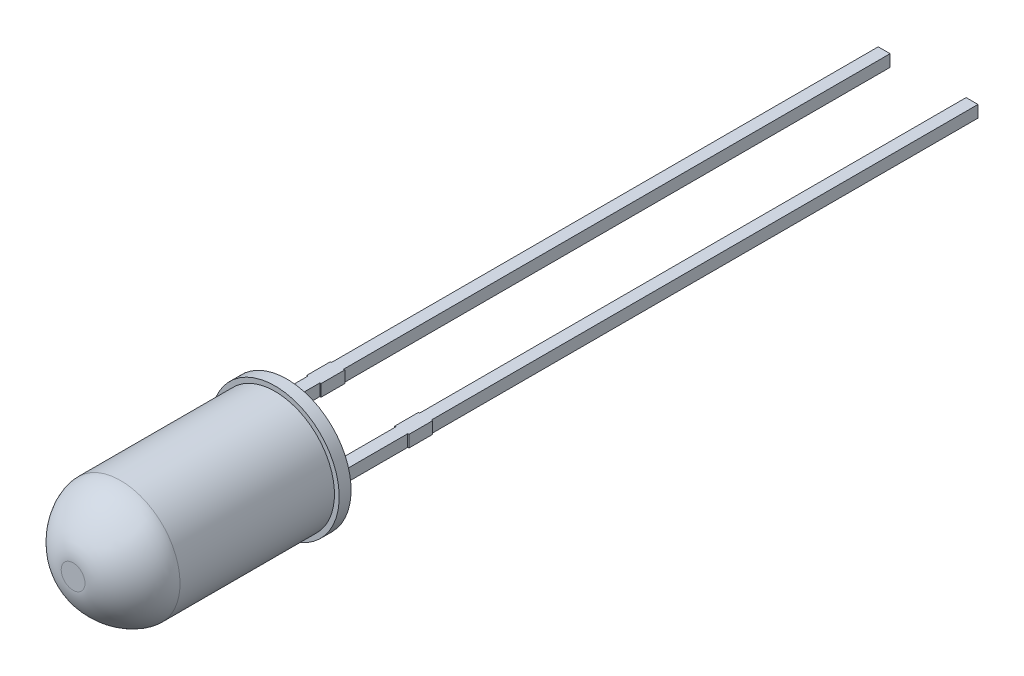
SolidWorks part; units mm, degrees
ref_plane "Plan de face" through (0, 0, 0) normal (0, 0, 1) x (1, 0, 0)
ref_plane "Plan de dessus" through (0, 0, 0) normal (0, 1, 0) x (1, 0, 0)
ref_plane "Plan de droite" through (0, 0, 0) normal (1, 0, 0) x (0, 0, -1)
sketch "Esquisse1" plane through (0, 0, 0) normal (0, 0, 1) x (1, 0, 0)
  circle A0 centre (0, 0) radius 2.5
extrude "Boss.-Extru.1" add sketch "Esquisse1" along normal blind 9
fillet "Congé1" radius 2 1 edges at (2.5, 0, 9)
sketch "Esquisse3" plane through (0, 0, 0) normal (0, 0, -1) x (-1, 0, 0)
  circle A0 centre (0, 0) radius 2.7
extrude "Boss.-Extru.3" add sketch "Esquisse3" against normal blind 0.5
sketch "Esquisse4" plane through (0, 0, 0) normal (0, 0, -1) x (-1, 0, 0)
  line L0 (0, 0) -> (-2.7, 0)
  line L1 (0, 0) -> (2.7, 0)
  line L2 (0, 2.7) -> (0, -2.7)
  line L3 (-2.084, -0.25) -> (-2.084, 0.25)
  line L4 (-2.084, 0.25) -> (-1.584, 0.25)
  line L5 (-1.584, 0.25) -> (-1.584, -0.25)
  line L6 (-1.584, -0.25) -> (-2.084, -0.25)
  line L7 (2.116, 0.25) -> (2.116, -0.25)
  line L8 (1.616, 0.25) -> (2.116, 0.25)
  line L9 (1.616, -0.25) -> (1.616, 0.25)
  line L10 (2.116, -0.25) -> (1.616, -0.25)
  circle A0 centre (0, 0) radius 2.7 construction
  point P12 (-2.084, 0)
  dimension "D1" = 2
extrude "Boss.-Extru.4" add sketch "Esquisse4" along normal blind 3 contours L9 L1 L7 L8 | L10 L7 L1 L9 | L5 L4 L3 L0 | L6 L5 L0 L3
sketch "Esquisse7" plane through (0, 0.25, 0) normal (0, 1, 0) x (1, 0, 0)
  line L0 (-1.566, 3) -> (-2.166, 3)
  line L2 (-2.166, 3) -> (-2.166, 4)
  line L3 (-2.166, 4) -> (-1.566, 4)
  line L4 (-1.566, 4) -> (-1.566, 3)
  line L5 (2.134, 4) -> (2.134, 3)
  line L6 (2.134, 3) -> (1.534, 3)
  line L7 (1.534, 3) -> (1.534, 4)
  line L8 (1.534, 4) -> (2.134, 4)
  point P3 (-1.866, 3)
  dimension "D1" = 2
extrude "Boss.-Extru.6" add sketch "Esquisse7" against normal up to surface (0.5 mm away)
sketch "Esquisse8" plane through (0, 0, 0) normal (0, 0, -1) x (-1, 0, 0)
  line L2 (-2.084, -0.25) -> (-1.584, -0.25)
  line L3 (-2.084, -0.25) -> (-2.084, 0.25)
  line L4 (-2.084, 0.25) -> (-1.584, 0.25)
  line L6 (-1.584, -0.25) -> (-1.584, 0.25)
  line L7 (1.616, -0.25) -> (2.116, -0.25)
  line L8 (1.616, -0.25) -> (1.616, 0.25)
  line L9 (1.616, 0.25) -> (2.116, 0.25)
  line L10 (2.116, -0.25) -> (2.116, 0.25)
extrude "Boss.-Extru.7" add sketch "Esquisse8" along normal blind 27
